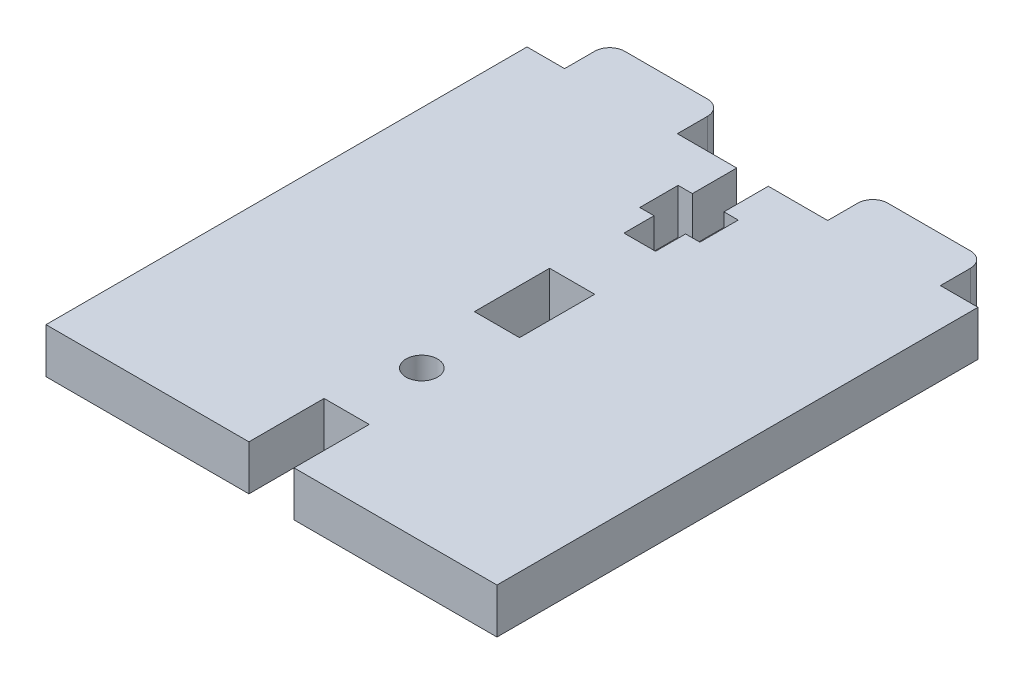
SolidWorks part; units mm, degrees
ref_plane "Спереди" through (0, 0, 0) normal (0, 0, 1) x (1, 0, 0)
ref_plane "Сверху" through (0, 0, 0) normal (0, 1, 0) x (1, 0, 0)
ref_plane "Справа" through (0, 0, 0) normal (1, 0, 0) x (0, 0, -1)
sketch "Эскиз1" plane through (0, 0, 0) normal (0, 1, 0) x (1, 0, 0)
  line L1 (0, 0) -> (60, 0)
  line L2 (0, 0) -> (0, -64)
  line L3 (0, -64) -> (60, -64)
  line L4 (60, 0) -> (60, -64)
  line L5 (5, 0) -> (20, 0)
  line L6 (5, 0) -> (5, 4)
  line L7 (7, 6) -> (18, 6)
  line L8 (20, 0) -> (20, 4)
  line L9 (40, 0) -> (55, 0)
  line L10 (40, 0) -> (40, 4)
  line L11 (42, 6) -> (53, 6)
  line L12 (55, 0) -> (55, 4)
  line L13 (27.9, 0) -> (32.1, 0)
  line L14 (27.9, 0) -> (27.9, -15)
  line L15 (27.9, -15) -> (32.1, -15)
  line L16 (32.1, 0) -> (32.1, -15)
  line L17 (26, -5.9) -> (34, -5.9)
  line L18 (26, -5.9) -> (26, -11)
  line L19 (26, -11) -> (34, -11)
  line L20 (34, -5.9) -> (34, -11)
  line L21 (27, -24) -> (33, -24)
  line L22 (27, -24) -> (27, -34)
  line L23 (27, -34) -> (33, -34)
  line L24 (33, -24) -> (33, -34)
  line L25 (27, -54) -> (33, -54)
  line L26 (27, -54) -> (27, -64)
  line L27 (27, -64) -> (33, -64)
  line L28 (33, -54) -> (33, -64)
  arc A0 (53, 6) -> (55, 4) centre (53, 4) cw
  arc A1 (40, 4) -> (42, 6) centre (42, 4) cw
  arc A2 (18, 6) -> (20, 4) centre (18, 4) cw
  arc A3 (5, 4) -> (7, 6) centre (7, 4) cw
  circle A4 centre (30, -44) radius 2.1
  point P15 (55, 6)
  point P18 (40, 6)
  point P21 (20, 6)
  point P24 (5, 6)
  point P33 (30, -15)
  point P34 (30, -11)
  point P45 (30, -34)
  point P46 (30, -54)
extrude "Бобышка-Вытянуть1" add sketch "Эскиз1" along normal blind 6 contours A3 L6 L1 L8 A2 L7 | A1 L10 L1 L12 A0 L11 | L17 L20 L19 L16 L15 L14 L18 L1 L2 L3 L4 A4 L21 L24 L23 L22 L25 L28 L27 L26
equation "\"D14@Эскиз1\"=\"D2@Эскиз1\"/2"
equation "\"D21@Эскиз1\"=\"D20@Эскиз1\"/2"
